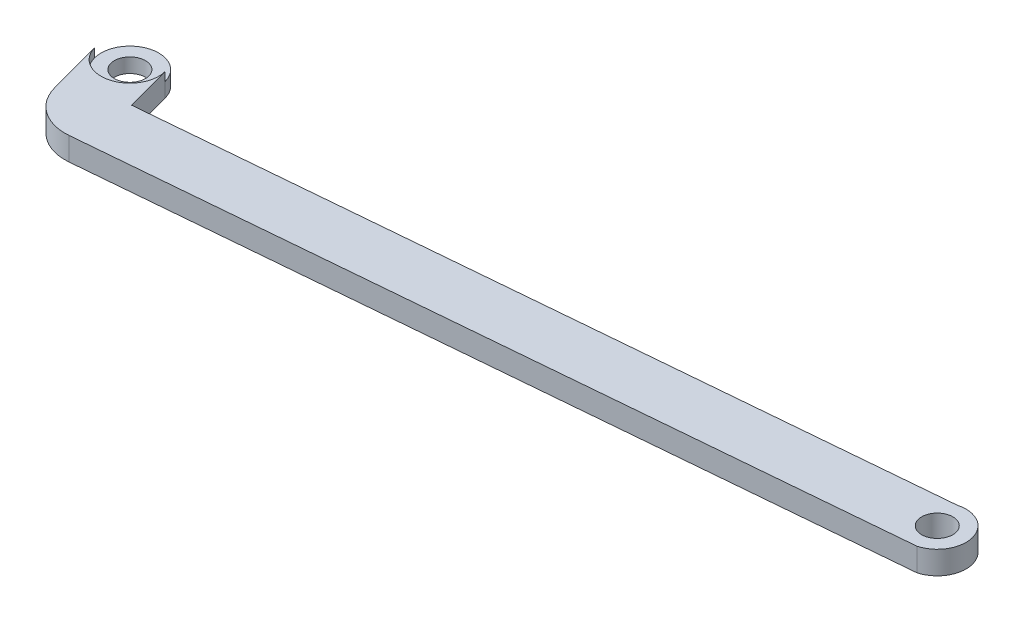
SolidWorks part; units mm, degrees
ref_plane "Front Plane" through (0, 0, 0) normal (0, 0, 1) x (1, 0, 0)
ref_plane "Top Plane" through (0, 0, 0) normal (0, 1, 0) x (1, 0, 0)
ref_plane "Right Plane" through (0, 0, 0) normal (1, 0, 0) x (0, 0, -1)
sketch "Sketch1" plane through (0, 0, 0) normal (0, 1, 0) x (1, 0, 0)
  line L4 (-183.9336, -1.6435) -> (-180.7138, -13.66)
  line L5 (-171.6664, 1.6435) -> (-168.9475, -8.5036)
  line L9 (-1.6435, 6.1336) -> (-168.9475, -8.5036)
  line L10 (1.6435, -6.1336) -> (-170.0145, -21.1518)
  circle A0 centre (0, 0) radius 3.429
  circle A1 centre (-177.8, 0) radius 3.429
  arc A4 (1.6435, -6.1336) -> (-1.6435, 6.1336) centre (0, 0) ccw
  arc A5 (-171.6664, 1.6435) -> (-183.9336, -1.6435) centre (-177.8, 0) ccw
  arc A6 (-170.0145, -21.1518) -> (-180.7138, -13.66) centre (-170.9, -11.0304) cw
  dimension "D1" = 6.858
  dimension "D2" = 6.858
  dimension "D3" = 177.8
  dimension "D4" = 12.7
  dimension "D5" = 12.7
  dimension "D6" = 10.16
  dimension "D7" = 100
  dimension "D9" = 0
extrude "Boss-Extrude1" add sketch "Sketch1" along normal blind 5.08
sketch "Sketch2" plane through (0, 5.08, 0) normal (0, 1, 0) x (1, 0, 0)
  circle A0 centre (-177.8, 0) radius 6.35
extrude "Cut-Extrude1" cut sketch "Sketch2" against normal blind 1.905
